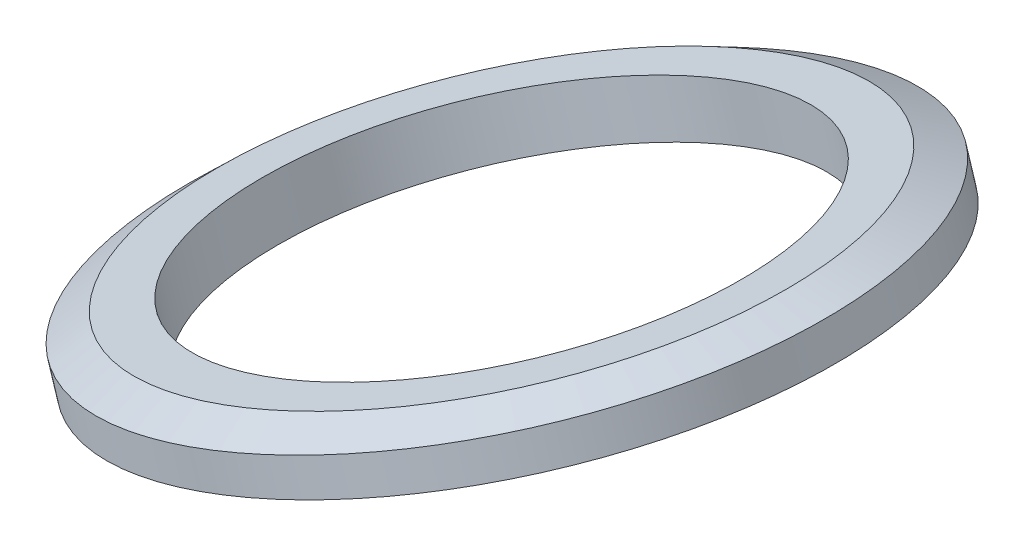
SolidWorks part; units mm, degrees
ref_plane "Alzado" through (0, 0, 0) normal (0, 0, 1) x (1, 0, 0)
ref_plane "Planta" through (0, 0, 0) normal (0, 1, 0) x (1, 0, 0)
ref_plane "Vista lateral" through (0, 0, 0) normal (1, 0, 0) x (0, 0, -1)
sketch "Sk_Cono" plane through (0, 0, 0) normal (0, 0, 1) x (1, 0, 0)
  line L0 (422.136, 400.5414) -> (424.711, 401.3533)
  line L1 (424.711, 401.3533) -> (426.9191, 401.001)
  line L2 (426.9191, 401.001) -> (427.5206, 399.0936)
  line L3 (427.5206, 399.0936) -> (423.0381, 397.6802)
  line L4 (423.0381, 397.6802) -> (422.136, 400.5414)
  line L5 (406.9943, 401.0097) -> (417.5193, 367.6297) construction
revolve "Cono" add sketch "Sk_Cono" angle 360 about L5
